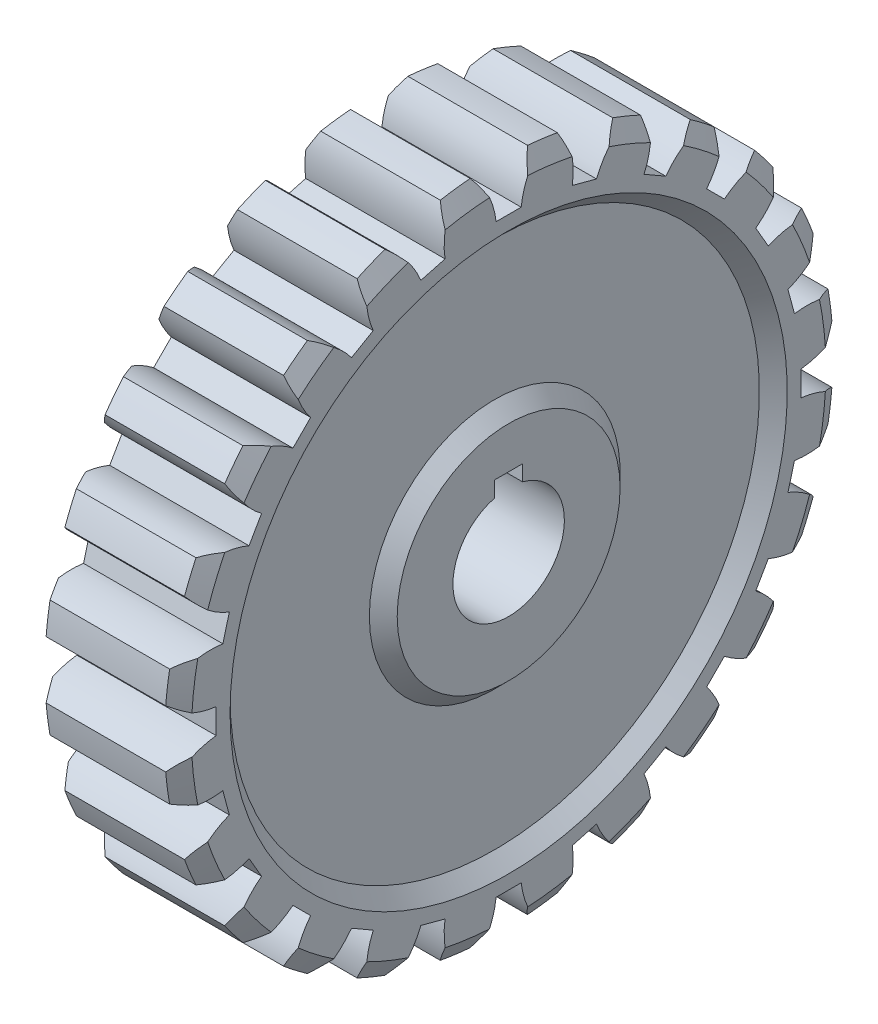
SolidWorks part; units mm, degrees
ref_plane "Front" through (0, 0, 0) normal (0, 0, 1) x (1, 0, 0)
ref_plane "Top" through (0, 0, 0) normal (0, 1, 0) x (1, 0, 0)
ref_plane "Right" through (0, 0, 0) normal (1, 0, 0) x (0, 0, -1)
sketch "Sketch1" plane through (0, 0, 0) normal (0, 0, 1) x (1, 0, 0)
  line L0 (0, 0) -> (0, 95.0567) construction
  line L1 (-15.875, 12.7) -> (15.875, 12.7)
  line L2 (15.875, 12.7) -> (15.875, 25.4)
  line L3 (-15.875, 12.7) -> (-15.875, 25.4)
  line L4 (15.875, 25.4) -> (12.7, 28.575)
  line L5 (-15.875, 25.4) -> (-12.7, 28.575)
  line L6 (12.7, 28.575) -> (12.7, 60.325)
  line L7 (-12.7, 28.575) -> (-12.7, 60.325)
  line L8 (-15.875, 63.5) -> (-12.7, 60.325)
  line L9 (12.7, 60.325) -> (15.875, 63.5)
  line L10 (15.875, 63.5) -> (15.875, 72.3114)
  line L11 (-15.875, 63.5) -> (-15.875, 72.3114)
  line L12 (15.875, 72.3114) -> (13.6299, 76.2)
  line L13 (-15.875, 72.3114) -> (-13.6299, 76.2)
  line L14 (13.6299, 76.2) -> (-13.6299, 76.2)
  line L15 (0, 0) -> (40.967, 0) construction
  point P6 (0, 12.7)
  point P18 (0, 76.2)
  dimension "D1" = 12.7
  dimension "D2" = 25.4
  dimension "D3" = 63.5
  dimension "D4" = 76.2
  dimension "D5" = 30
  dimension "D6" = 135
  dimension "D7" = 25.4
  dimension "D8" = 31.75
revolve "Revolve2" add sketch "Sketch1" angle 360 about L15
sketch "Sketch4" plane through (15.875, 0, 0) normal (1, 0, 0) x (0, 0, -1)
  line L0 (0, 0) -> (0, 84.0024) construction
  line L1 (-2.8575, 66.675) -> (2.8575, 66.675)
  arc A0 (6.5405, 75.9188) -> (2.8575, 66.675) centre (21.7818, 64.4906) ccw
  circle A1 centre (0, 0) radius 76.2 construction
  arc A2 (-6.5405, 75.9188) -> (-2.8575, 66.675) centre (-21.7818, 64.4906) cw
  arc A3 (6.5405, 75.9188) -> (-6.5405, 75.9188) centre (0, 0) ccw
  dimension "D3" = 19.05
  dimension "D1" = 5.715
  dimension "D2" = 13.081
  dimension "D4" = 66.675
extrude "Extrude1" cut sketch "Sketch4" against normal through all
pattern_circular "CirPattern1" count 24 over 360 about axis through (0, 0, 0) along (1, 0, 0) of "Extrude1"
sketch "Sketch5" plane through (15.875, 0, 0) normal (1, 0, 0) x (0, 0, -1)
  line L0 (0, 0) -> (0, 44.4082) construction
  line L1 (-3.175, 15.875) -> (3.175, 15.875)
  line L2 (3.175, 15.875) -> (3.175, 12.2967)
  line L3 (-3.175, 15.875) -> (-3.175, 12.2967)
  circle A0 centre (0, 0) radius 12.7 construction
  arc A1 (3.175, 12.2967) -> (-3.175, 12.2967) centre (0, 0) ccw
  point P6 (0, 15.875)
  dimension "D1" = 6.35
  dimension "D2" = 15.875
extrude "Extrude2" cut sketch "Sketch5" against normal through all
